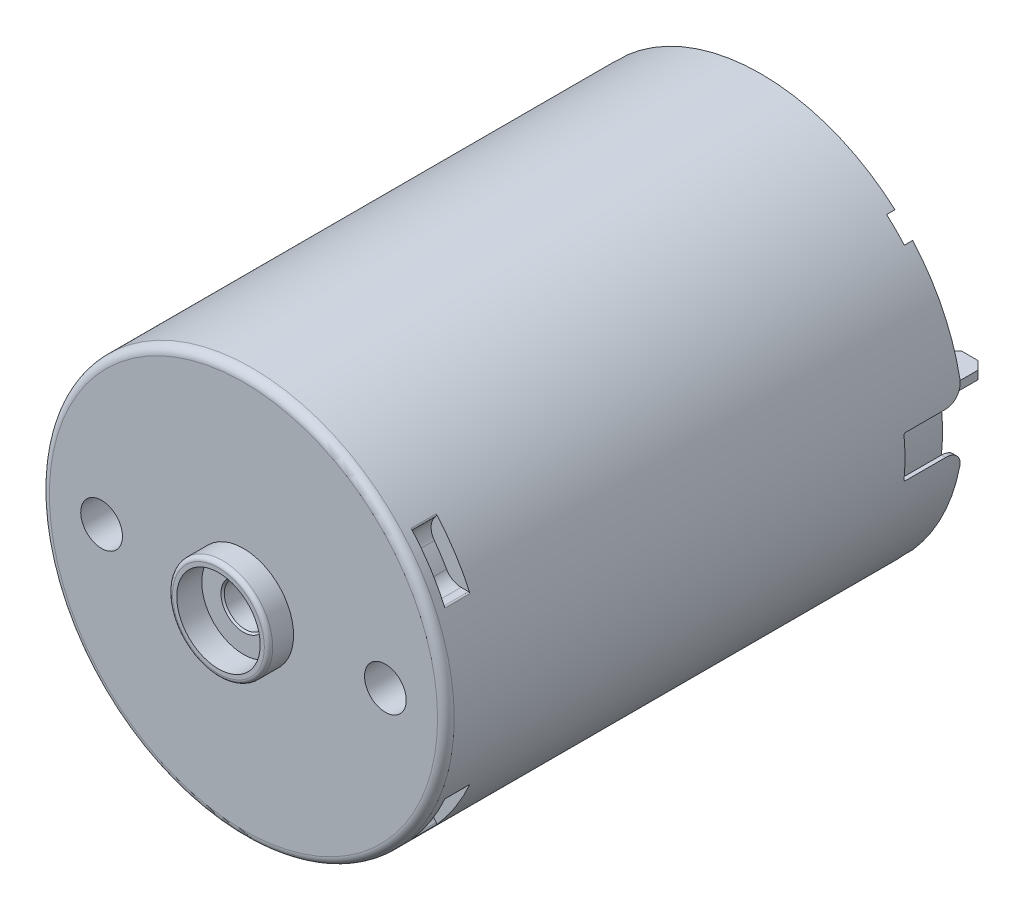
SolidWorks part; units mm, degrees
ref_plane "Front Plane" through (0, 0, 0) normal (0, 0, 1) x (1, 0, 0)
ref_plane "Top Plane" through (0, 0, 0) normal (0, 1, 0) x (1, 0, 0)
ref_plane "Right Plane" through (0, 0, 0) normal (1, 0, 0) x (0, 0, -1)
sketch "Sketch1" plane through (0, 0, 0) normal (0, 0, 1) x (1, 0, 0)
  circle A0 centre (0, 0) radius 12.125
  dimension "D1" = 24.25
extrude "Boss-Extrude1" add sketch "Sketch1" along normal mid plane 31 contours A0
fillet "Fillet1" radius 0.5 1 edges at (12.125, 0, 15.5)
ref_plane "Plane1" through (12.125, 0, 0) normal (1, 0, 0) x (0, 0, -1)
sketch "Sketch3" plane through (12.125, 0, 0) normal (1, 0, 0) x (0, 0, -1)
  line L0 (-15.5, 0) -> (15.5, 0) construction
  line L1 (-14.5, 8) -> (-13, 8)
  line L2 (-14.5, 8) -> (-14.5, 5)
  line L3 (-14.5, 5) -> (-13, 5)
  line L4 (-13, 8) -> (-13, 5)
  line L5 (-14.5, 8) -> (-13, 5) construction
  line L6 (-14.5, 5) -> (-13, 8) construction
  line L7 (-15.5, 11.625) -> (-15.5, -11.625) construction
  line L8 (15.5, -12.125) -> (15.5, 12.125) construction
  line L9 (-15, -12.125) -> (-15, 12.125) construction
  point P0 (-13.75, 6.5)
  dimension "D1" = 3
  dimension "D2" = 1.5
  dimension "D3" = 10
  dimension "D4" = 0.5
extrude "Cut-Extrude1" cut sketch "Sketch3" against normal offset from surface (4.3942 mm away) 1
fillet "Fillet2" radius 1 2 edges at (9.9381, 5, 13.75) (7.7308, 8, 13.75)
fillet "Fillet3" radius 0.1 2 edges at (11.0461, 5, 13.75) (9.1113, 8, 13.75)
mirror "Mirror1" about plane through (0, 0, 0) normal (0, 1, 0) of "Cut-Extrude1", "Fillet3", "Fillet2"
mirror "Mirror2" about plane through (0, 0, 0) normal (1, 0, 0) of "Mirror1", "Cut-Extrude1", "Fillet2", "Fillet3"
sketch "Sketch4" plane through (0, 0, -15.5) normal (0, 0, -1) x (-1, 0, 0)
  circle A0 centre (0, 0) radius 11.875
  circle A1 centre (0, 0) radius 12.125 construction
  dimension "D1" = 0.25
extrude "Cut-Extrude2" cut sketch "Sketch4" against normal blind 1
sketch "Sketch5" plane through (12.125, 0, 0) normal (1, 0, 0) x (0, 0, -1)
  line L0 (15.5, -12.125) -> (15.5, 12.125) construction
  line L1 (12, 1.25) -> (15.5, 1.25)
  line L2 (12, 1.25) -> (12, -1.25)
  line L3 (12, -1.25) -> (15.5, -1.25)
  line L4 (15.5, 1.25) -> (15.5, -1.25)
  line L5 (12, 1.25) -> (15.5, -1.25) construction
  line L6 (12, -1.25) -> (15.5, 1.25) construction
  point P0 (13.75, 0)
  dimension "D1" = 3.5
  dimension "D2" = 2.5
extrude "Cut-Extrude3" cut sketch "Sketch5" against normal up to surface (0.316 mm away)
fillet "Fillet4" radius 1 2 edges at (11.9347, -1.25, -15.5) (11.9347, 1.25, -15.5)
fillet "Fillet5" radius 0.1 2 edges at (11.9347, -1.25, -12) (11.9347, 1.25, -12)
sketch "Sketch6" plane through (0, 0, -14.5) normal (0, 0, -1) x (-1, 0, 0)
  circle A0 centre (0, 0) radius 3
  dimension "D1" = 6
extrude "Boss-Extrude2" add sketch "Sketch6" along normal blind 2.5
fillet "Fillet6" radius 0.75 1 edges at (-3, 0, -17)
sketch "Sketch8" plane through (0, 0, 15.5) normal (0, 0, 1) x (1, 0, 0)
  circle A0 centre (0, 0) radius 3
  circle A1 centre (0, 0) radius 3 construction
extrude "Boss-Extrude3" add sketch "Sketch8" along normal blind 1.5
sketch "Sketch9" plane through (0, 0, 17) normal (0, 0, 1) x (1, 0, 0)
  circle A0 centre (0, 0) radius 2.5
  circle A1 centre (0, 0) radius 3 construction
  dimension "D1" = 0.5
extrude "Cut-Extrude5" cut sketch "Sketch9" against normal blind 1.5
fillet "Fillet8" radius 0.25 1 edges at (3, 0, 17)
sketch "Sketch7" plane through (0, 0, -17) normal (0, 0, -1) x (-1, 0, 0)
  circle A0 centre (0, 0) radius 1.25
  dimension "D1" = 2.5
extrude "Cut-Extrude4" cut sketch "Sketch7" against normal up to next
chamfer "Chamfer2" distance 0.1 angle 45 2 edges at (-1.25, 0, -17) (1.25, 0, 15.5)
sketch "Sketch10" plane through (0, 0, 15.5) normal (0, 0, 1) x (1, 0, 0)
  line L0 (0, 0) -> (0, -50000) construction
  circle A0 centre (8.5, 0) radius 1.25
  dimension "D1" = 17
  dimension "D2" = 2.5
extrude "Cut-Extrude6" cut sketch "Sketch10" against normal blind 4 contours A0
mirror "Mirror3" about plane through (0, 0, 0) normal (1, 0, 0) of "Cut-Extrude6"
ref_plane "Plane2" through (8.5737, 8.5737, 0) normal (0.7071, 0.7071, 0) x (0.7071, -0.7071, 0)
sketch "Sketch11" plane through (8.5737, 8.5737, 0) normal (0.7071, 0.7071, 0) x (0.7071, -0.7071, 0)
  line L0 (12.125, 15.5) -> (-12.125, 15.5) construction
  line L1 (-0.75, 15) -> (0.75, 15)
  line L2 (-0.75, 15) -> (-0.75, 15.5)
  line L3 (-0.75, 15.5) -> (0.75, 15.5)
  line L4 (0.75, 15) -> (0.75, 15.5)
  line L5 (-0.75, 15) -> (0.75, 15.5) construction
  line L6 (-0.75, 15.5) -> (0.75, 15) construction
  point P0 (0, 15.25)
  dimension "D1" = 1.5
  dimension "D2" = 0.5
extrude "Cut-Extrude7" cut sketch "Sketch11" against normal up to next contours L1 L4 L3 L2
pattern_circular "CirPattern1" count 4 over 360 about axis through (0, 0, 0) along (0, 0, 1) of "Cut-Extrude7"
sketch "Sketch12" plane through (0, 0, -14.5) normal (0, 0, -1) x (-1, 0, 0)
  line L1 (-10, 0.25) -> (-8, 0.25)
  line L2 (-10, 0.25) -> (-10, -0.25)
  line L3 (-10, -0.25) -> (-8, -0.25)
  line L4 (-8, 0.25) -> (-8, -0.25)
  line L5 (-10, 0.25) -> (-8, -0.25) construction
  line L6 (-10, -0.25) -> (-8, 0.25) construction
  point P0 (-9, 0)
  dimension "D1" = 2
  dimension "D2" = 0.5
  dimension "D3" = 9
extrude "Boss-Extrude4" add sketch "Sketch12" along normal blind 4.5 contours L3 L4 L1 L2
chamfer "Chamfer4" distance 0.5 angle 45 2 edges at (8, 0, -19) (10, 0, -19)
sketch "Sketch13" plane through (0, -0.25, 0) normal (0, -1, 0) x (1, 0, 0)
  line L1 (8.8, -16.5) -> (9.2, -16.5)
  line L2 (8.6, -16.7) -> (8.6, -17.8)
  line L3 (8.8, -18) -> (9.2, -18)
  line L4 (9.4, -16.7) -> (9.4, -17.8)
  line L5 (8.6, -16.5) -> (9.4, -18) construction
  line L6 (8.6, -18) -> (9.4, -16.5) construction
  line L7 (9.5, -19) -> (8.5, -19) construction
  line L8 (9, -19) -> (9, -50019) construction
  arc A0 (8.8, -16.5) -> (8.6, -16.7) centre (8.8, -16.7) ccw
  arc A1 (9.2, -16.5) -> (9.4, -16.7) centre (9.2, -16.7) cw
  arc A2 (9.2, -18) -> (9.4, -17.8) centre (9.2, -17.8) ccw
  arc A3 (8.6, -17.8) -> (8.8, -18) centre (8.8, -17.8) ccw
  point P0 (9, -17.25)
  point P9 (9, -19)
  dimension "D4" = 0.2
  dimension "D5" = 0.2
  dimension "D6" = 0.2
  dimension "D7" = 0.2
  dimension "D1" = 0.8
  dimension "D2" = 1.5
  dimension "D3" = 1
extrude "Cut-Extrude9" cut sketch "Sketch13" against normal up to next contours L2 A3 L3 A2 L4 A1 L1 A0
mirror "Mirror4" about plane through (0, 0, 0) normal (1, 0, 0) of "Cut-Extrude9", "Chamfer4", "Boss-Extrude4"
